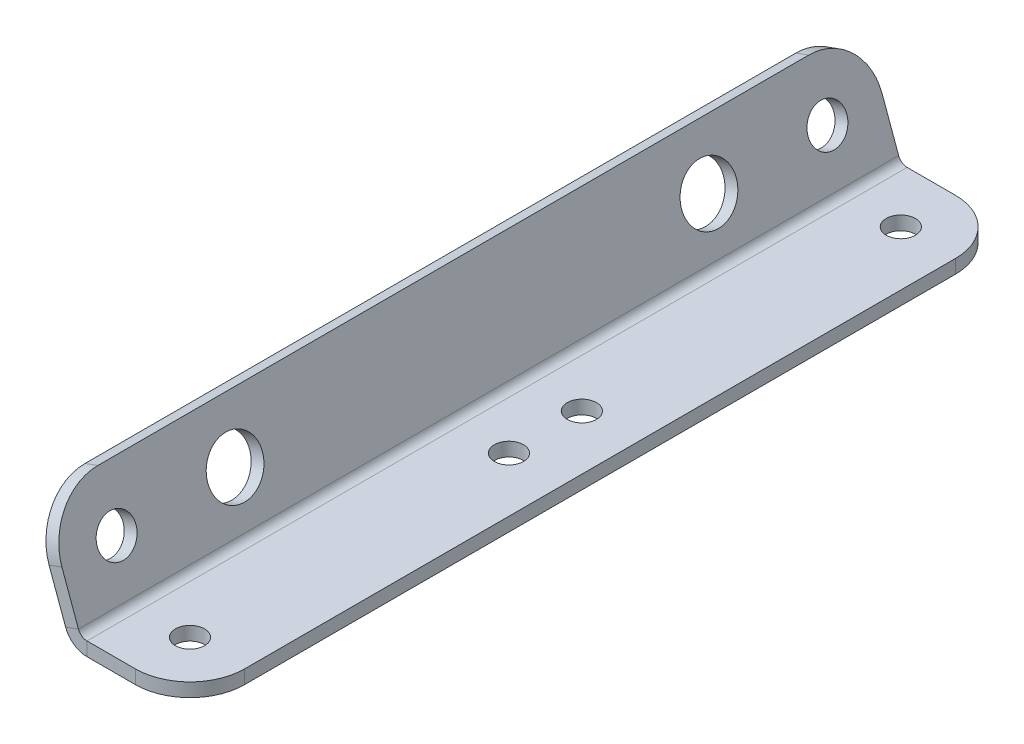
SolidWorks part; units mm, degrees
ref_plane "Plan1" through (0, 0, 0) normal (0, 0, 1) x (1, 0, 0)
ref_plane "Plan2" through (0, 0, 0) normal (0, 1, 0) x (1, 0, 0)
ref_plane "Plan3" through (0, 0, 0) normal (1, 0, 0) x (0, 0, -1)
sketch "Esquisse1" plane through (0, 0, 0) normal (0, 0, 1) x (1, 0, 0)
  line L0 (0, 0) -> (24, 0)
  line L1 (0, 0) -> (-8.2085, 22.5526)
  dimension "D1" = 110
  dimension "D2" = 24
  dimension "D3" = 24
extrude "Base-Extru.-Mince" add sketch "Esquisse1" along normal mid plane 180 thin
sheet metal parameters "Tôlerie 1" parameters "D1"=2
bend "Pli dans angle1" bend angle 70 parameters "D1"=0, "D5"=1
flatten bends "Dépliage 1" parameters "D1"=0
sketch "Esquisse-Angle1" plane through (0, 0, 0) normal (0, 1, 0) x (-1, 0, 0)
  line L0 (0.7376, -90) -> (0.7376, 90) construction
sketch "Esquisse4" plane through (0, 0, 0) normal (0, 1, 0) x (-1, 0, 0)
  line L0 (13.4752, -100) -> (13.4752, 100) construction
  line L1 (-12, -100) -> (-12, 97) construction
  line L2 (25.4752, 90) -> (25.4752, -90) construction
  line L3 (-24, 90) -> (-24, -90) construction
  line L4 (-44, 0) -> (45, 0) construction
  line L5 (30, 78) -> (-32, 78) construction
  line L6 (2.8756, 90) -> (25.4752, 90) construction
  line L7 (2.8756, 52) -> (45, 52) construction
  line L9 (-24, 8) -> (2.8756, 8) construction
  circle A0 centre (13.4752, 78) radius 4.25
  circle A1 centre (13.4752, 52) radius 6
  circle A2 centre (-12, 78) radius 3.2
  circle A3 centre (-12, 8) radius 3.2
  circle A4 centre (13.4752, -78) radius 4.25
  circle A5 centre (-12, -78) radius 3.2
  circle A6 centre (13.4752, -52) radius 6
  circle A7 centre (-12, -8) radius 3.2
  dimension "D5" = 12
  dimension "D6" = 8.5
  dimension "D7" = 6.4
  dimension "D1" = 12
  dimension "D2" = 12
  dimension "D3" = 12
  dimension "D4" = 38
  dimension "D8" = 70
extrude "Enlèv. mat.-Extru.1" cut sketch "Esquisse4" against normal through all
process bends "Pliage 1" parameters "D1"=0
sketch "Esquisse-Plate1" plane through (0, 0, 0) normal (0, 1, 0) x (-1, 0, 0)
fillet "Congé1" radius 12
